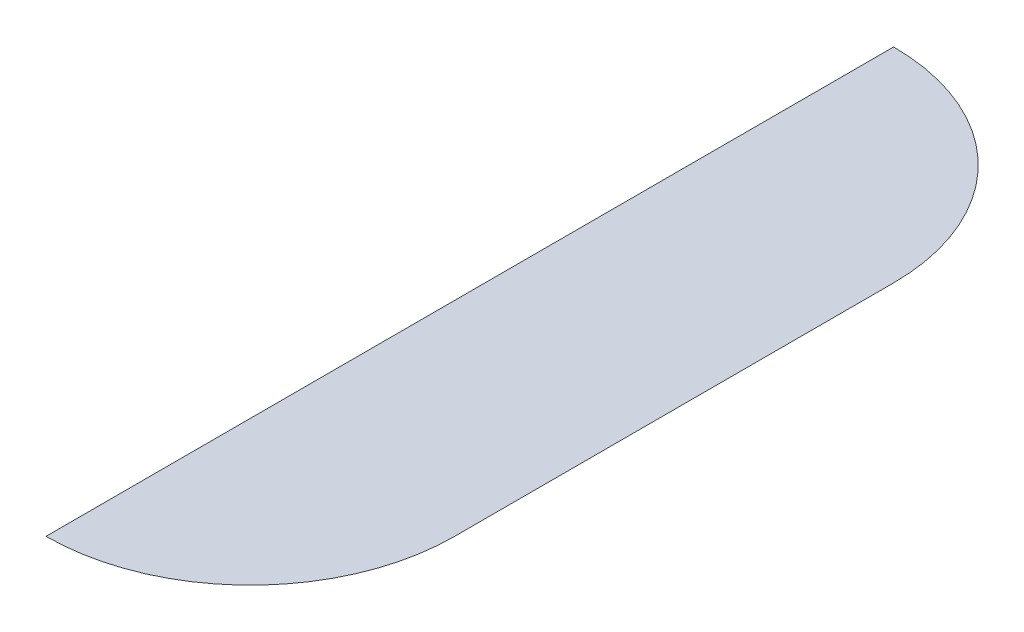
SolidWorks part; units mm, degrees
extrude "Base-Extrude" add sketch "Sketch1" along normal mid plane 76.2
sketch "Sketch1" plane through (0, 0, 0) normal (0, 0, 1) x (1, 0, 0)
  line L0 (-15, 0) -> (15, 0)
  line L1 (-15, 0) -> (-15, 3.4642)
  line L2 (15, 3.4642) -> (-15, 3.4642)
  line L3 (15, 3.4642) -> (15, 0)
  line L4 (0, 0) -> (0, 3.4642) construction
  line L5 (50, 0) -> (-50, 0) construction
  dimension "D1" = 30
ref_plane "Plane1" through (0, 0, 0) normal (0, 0, 1) x (1, 0, 0)
ref_plane "Plane2" through (0, 0, 0) normal (0, 1, 0) x (1, 0, 0)
ref_plane "Plane3" through (0, 0, 0) normal (1, 0, 0) x (0, 0, -1)
sketch "Layout Sketch" plane through (0, 0, 0) normal (0, -1, 0) x (1, 0, 0)
  line L0 (-6.5173, 0) -> (7.2244, 0) construction
  line L1 (11.2638, 0) -> (-11.2638, 0) construction
  line L2 (0, 9.1132) -> (0, -7.6236) construction
  line L3 (0, -50) -> (0, 50) construction
  line L9 (-5.4737, -23.6474) -> (-5.4737, 23.6474)
  line L11 (5.4737, 12.7) -> (5.4737, -12.7)
  arc A0 (5.4737, 12.7) -> (-5.4737, 23.6474) centre (-5.4737, 12.7) ccw
  arc A1 (5.4737, -12.7) -> (-5.4737, -23.6474) centre (-5.4737, -12.7) cw
  dimension "Overall width" = 47.2948
  dimension "Depth" = 10.9474
sketch "Louver Body" plane through (0, 0, 0) normal (0, 0, 1) x (1, 0, 0)
  line L0 (-5.4737, 0) -> (-5.4737, -4.826)
  line L1 (-15, 0) -> (15, 0) construction
  line L2 (-5.4737, 0) -> (5.4737, 0)
  line L4 (5.4737, 0) -> (5.4737, 3.4642) construction
  line L5 (15, 3.4642) -> (-15, 3.4642) construction
  line L6 (-5.4737, -4.826) -> (-3.0249, -4.826) construction
  line L8 (0, 3.4642) -> (0, 0) construction
  arc A0 (-5.4737, -4.826) -> (5.4737, 0) centre (-1.0637, 0) ccw construction
  arc A1 (5.4737, 0) -> (-5.4737, -4.826) centre (-5.4737, 10.0037) cw
  dimension "D1" = 4.826
extrude "Boss-Extrude1" add sketch "Louver Body" along normal mid plane 25.4
sketch "Sketch12" plane through (0, 0, 12.7) normal (0, 0, 1) x (1, 0, 0)
  line L0 (-5.4737, 0) -> (-5.4737, -4.826) construction
  line L1 (-5.4737, 0) -> (-5.4737, -4.826) construction
  line L2 (-15, 0) -> (15, 0) construction
  line L5 (5.4737, 0) -> (-5.4737, 0)
  line L6 (-5.4737, 0) -> (-5.4737, -4.826)
  line L7 (5.4737, 0) -> (-5.4737, 0)
  line L8 (-5.4737, 0) -> (-5.4737, -4.826)
  arc A2 (-5.4737, -4.826) -> (5.4737, 0) centre (-5.4737, 10.0037) ccw
  arc A3 (-5.4737, -4.826) -> (5.4737, 0) centre (-5.4737, 10.0037) ccw
  dimension "D1" = 0
revolve "Boss-Revolve2" add sketch "Sketch12" angle 90 about L1
sketch "Sketch13" plane through (0, 0, -12.7) normal (0, 0, -1) x (-1, 0, 0)
  line L0 (5.4737, -4.826) -> (5.4737, 0) construction
  line L1 (15, 0) -> (-15, 0) construction
  line L2 (5.4737, 0) -> (-5.4737, 0)
  line L3 (5.4737, -4.826) -> (5.4737, 0)
  line L4 (5.4737, 0) -> (-5.4737, 0)
  line L5 (5.4737, -4.826) -> (5.4737, 0)
  arc A1 (-5.4737, 0) -> (5.4737, -4.826) centre (5.4737, 10.0037) ccw
  arc A2 (-5.4737, 0) -> (5.4737, -4.826) centre (5.4737, 10.0037) ccw
  dimension "D1" = 0
revolve "Boss-Revolve3" add sketch "Sketch13" angle 90 about L0
fillet "Fillet1" radius 2.0701 3 edges at (5.4737, 0, 0) (2.2673, 0, 20.441) (2.2673, 0, -20.441)
sketch "Sketch8" plane through (-15, 0, 0) normal (-1, 0, 0) x (0, 0, 1)
  line L4 (-38.1, 0) -> (38.1, 0)
  line L5 (38.1, 0) -> (38.1, 3.4642)
  line L6 (38.1, 3.4642) -> (-38.1, 3.4642)
  line L7 (-38.1, 3.4642) -> (-38.1, 0)
  line L8 (-38.1, 0) -> (38.1, 0)
  line L9 (38.1, 0) -> (38.1, 3.4642)
  line L10 (38.1, 3.4642) -> (-38.1, 3.4642)
  line L11 (-38.1, 3.4642) -> (-38.1, 0)
  dimension "D1" = 0
extrude "Cut-Extrude4" cut sketch "Sketch8" against normal through all
sketch "Orientation sketch" plane through (0, 0, 0) normal (0, 1, 0) x (-1, 0, 0)
  line L2 (5.4737, 24.5248) -> (5.4737, -24.5248)
  line L3 (5.4737, 24.5248) -> (5.4737, -24.5248)
  line L4 (-6.3511, 12.7) -> (-6.3511, -12.7)
  line L5 (-6.3511, 12.7) -> (-6.3511, -12.7)
  arc A2 (5.4737, 24.5248) -> (-6.3511, 12.7) centre (5.4737, 12.7) ccw
  arc A3 (5.4737, 24.5248) -> (-6.3511, 12.7) centre (5.4737, 12.7) ccw
  arc A4 (-6.3511, -12.7) -> (5.4737, -24.5248) centre (5.4737, -12.7) ccw
  arc A5 (-6.3511, -12.7) -> (5.4737, -24.5248) centre (5.4737, -12.7) ccw
  dimension "D1" = 0
equation "\"Width@Boss-Extrude1\"=\"Overall width@Layout Sketch\"-2*\"Depth@Layout Sketch\""
